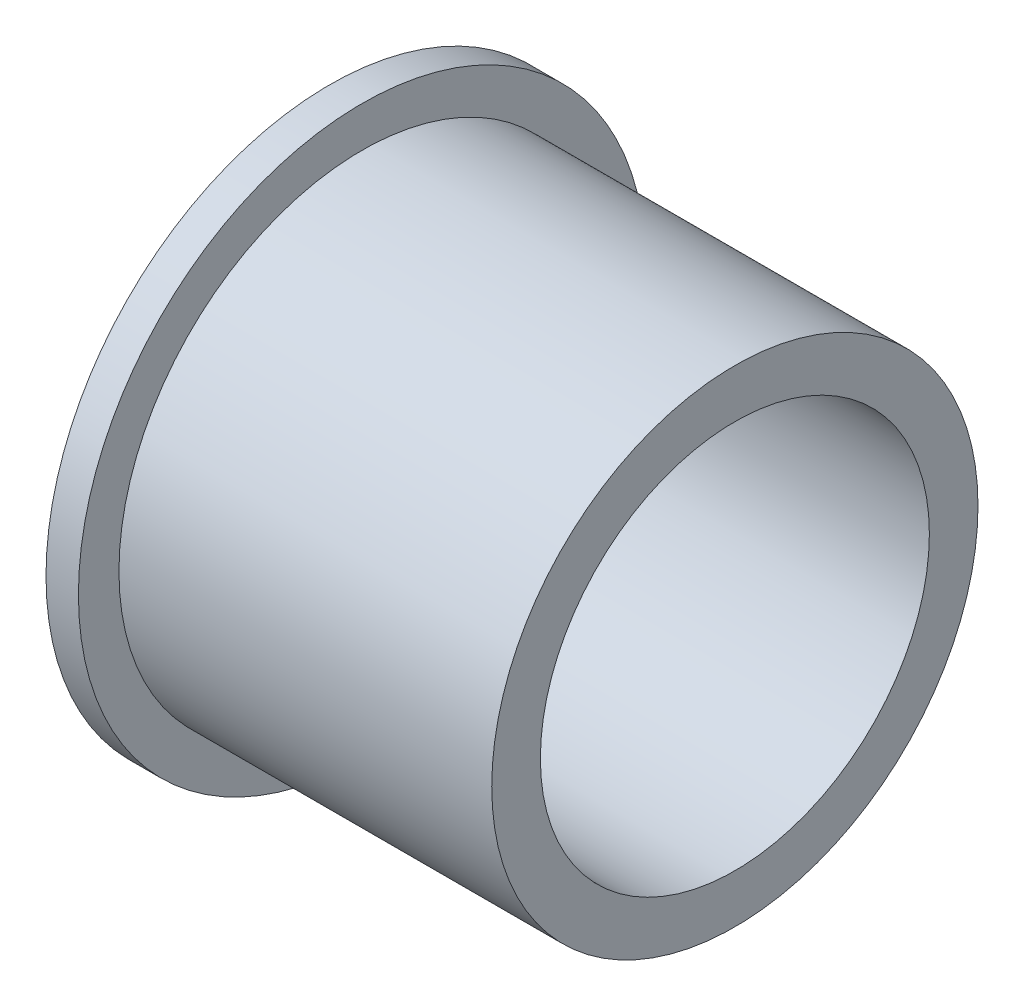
SolidWorks part; units mm, degrees
ref_plane "Plan1" through (0, 0, 0) normal (0, 0, 1) x (1, 0, 0)
ref_plane "Plan2" through (0, 0, 0) normal (0, 1, 0) x (1, 0, 0)
ref_plane "Plan3" through (0, 0, 0) normal (1, 0, 0) x (0, 0, -1)
sketch "Esquisse1" plane through (0, 0, 0) normal (0, 0, 1) x (1, 0, 0)
  line L0 (-10.5, 17.5) -> (-10.5, 15)
  line L1 (-10.5, 15) -> (12.5, 15)
  line L2 (12.5, 15) -> (12.5, 12)
  line L3 (12.5, 12) -> (-12.5, 12)
  line L4 (-12.5, 12) -> (-12.5, 17.5)
  line L5 (-12.5, 17.5) -> (-10.5, 17.5)
  line L6 (-12.5, 0) -> (12.5, 0) construction
  point P9 (0, 12)
  dimension "D1" = 30
  dimension "D2" = 24
  dimension "D3" = 35
  dimension "D4" = 2
  dimension "D5" = 25
revolve "Base-Révolution" add sketch "Esquisse1" angle 360 about L6
